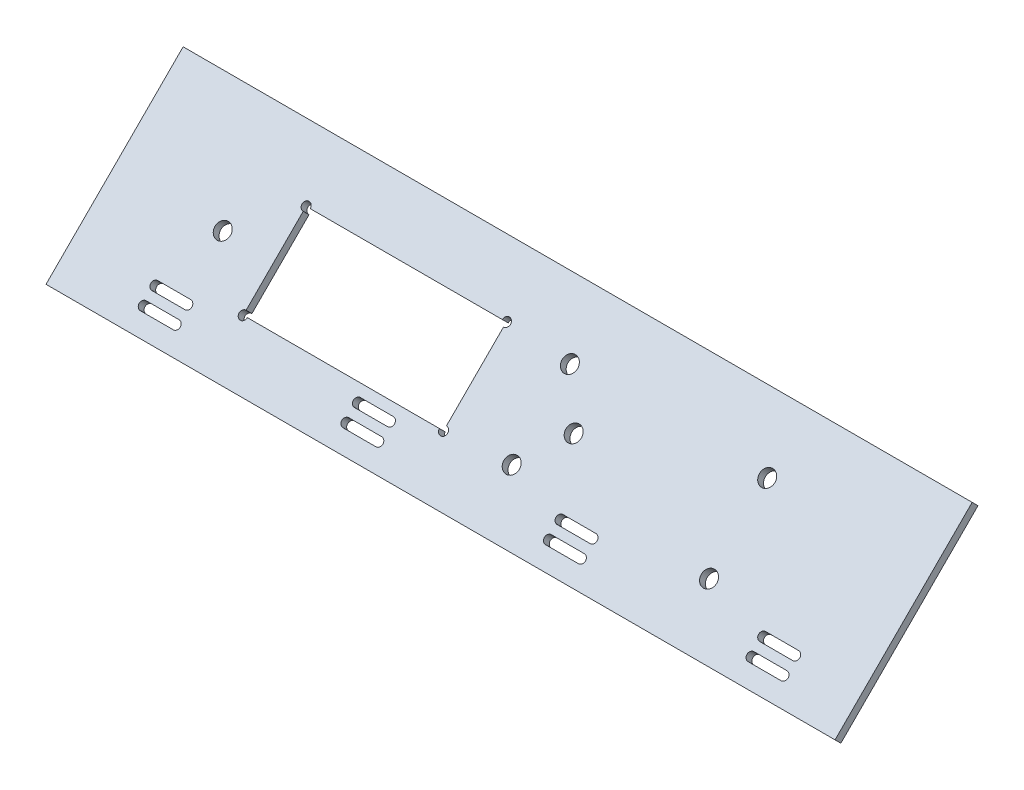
SolidWorks part; units mm, degrees
ref_plane "Front Plane" through (0, 0, 0) normal (0, 0, 1) x (1, 0, 0)
ref_plane "Top Plane" through (0, 0, 0) normal (0, 1, 0) x (1, 0, 0)
ref_plane "Right Plane" through (0, 0, 0) normal (1, 0, 0) x (0, 0, -1)
sketch "Sketch2" plane through (0, 874.2582, 874.2582) normal (0, 0.7071, 0.7071) x (1, 0, 0)
  line L0 (-880.4529, -726.3115) -> (-867.7529, -726.3115) construction
  line L1 (-867.7529, -723.1365) -> (-880.4529, -723.1365) construction
  line L2 (-867.7529, -729.4865) -> (-880.4529, -729.4865) construction
  line L3 (-880.4529, -732.6615) -> (-867.7529, -732.6615) construction
  line L4 (-802.2209, -732.6615) -> (-789.5209, -732.6615) construction
  line L5 (-789.5209, -729.4865) -> (-802.2209, -729.4865) construction
  line L6 (-802.2209, -726.3115) -> (-789.5209, -726.3115) construction
  line L7 (-789.5209, -723.1365) -> (-802.2209, -723.1365) construction
  line L8 (-711.2889, -723.1365) -> (-723.9889, -723.1365) construction
  line L9 (-723.9889, -726.3115) -> (-711.2889, -726.3115) construction
  line L10 (-711.2889, -729.4865) -> (-723.9889, -729.4865) construction
  line L11 (-723.9889, -732.6615) -> (-711.2889, -732.6615) construction
  line L12 (-645.7569, -726.3115) -> (-633.0569, -726.3115) construction
  line L13 (-633.0569, -723.1365) -> (-645.7569, -723.1365) construction
  line L14 (-633.0569, -729.4865) -> (-645.7569, -729.4865) construction
  line L15 (-645.7569, -732.6615) -> (-633.0569, -732.6615) construction
  line L16 (-607.5404, -664.399) -> (-607.5404, -739.2838) construction
  line L17 (-607.5404, -664.399) -> (-912.2029, -664.399) construction
  line L18 (-912.2029, -664.399) -> (-912.2029, -739.2838) construction
  line L19 (-607.5404, -739.2838) -> (-912.2029, -739.2838) construction
  line L20 (-880.4529, -726.3115) -> (-867.7529, -726.3115)
  line L21 (-867.7529, -723.1365) -> (-880.4529, -723.1365)
  line L22 (-867.7529, -729.4865) -> (-880.4529, -729.4865)
  line L23 (-880.4529, -732.6615) -> (-867.7529, -732.6615)
  line L24 (-802.2209, -732.6615) -> (-789.5209, -732.6615)
  line L25 (-789.5209, -729.4865) -> (-802.2209, -729.4865)
  line L26 (-802.2209, -726.3115) -> (-789.5209, -726.3115)
  line L27 (-789.5209, -723.1365) -> (-802.2209, -723.1365)
  line L28 (-711.2889, -723.1365) -> (-723.9889, -723.1365)
  line L29 (-723.9889, -726.3115) -> (-711.2889, -726.3115)
  line L30 (-711.2889, -729.4865) -> (-723.9889, -729.4865)
  line L31 (-723.9889, -732.6615) -> (-711.2889, -732.6615)
  line L32 (-645.7569, -726.3115) -> (-633.0569, -726.3115)
  line L33 (-633.0569, -723.1365) -> (-645.7569, -723.1365)
  line L34 (-633.0569, -729.4865) -> (-645.7569, -729.4865)
  line L35 (-645.7569, -732.6615) -> (-633.0569, -732.6615)
  line L36 (-607.5404, -664.399) -> (-607.5404, -739.2838)
  line L37 (-607.5404, -664.399) -> (-912.2029, -664.399)
  line L38 (-912.2029, -664.399) -> (-912.2029, -739.2838)
  line L39 (-607.5404, -739.2838) -> (-912.2029, -739.2838)
  circle A0 centre (-670.9716, -686.624) radius 3 construction
  circle A1 centre (-670.9716, -718.374) radius 3 construction
  circle A2 centre (-747.1716, -718.374) radius 3 construction
  circle A3 centre (-734.4716, -702.499) radius 3 construction
  circle A4 centre (-747.1716, -686.624) radius 3 construction
  circle A5 centre (-869.9716, -702.499) radius 3 construction
  arc A6 (-880.4529, -723.1365) -> (-880.4529, -726.3115) centre (-880.4529, -724.724) ccw construction
  arc A7 (-867.7529, -726.3115) -> (-867.7529, -723.1365) centre (-867.7529, -724.724) ccw construction
  arc A8 (-867.7529, -732.6615) -> (-867.7529, -729.4865) centre (-867.7529, -731.074) ccw construction
  arc A9 (-880.4529, -729.4865) -> (-880.4529, -732.6615) centre (-880.4529, -731.074) ccw construction
  arc A10 (-789.5209, -732.6615) -> (-789.5209, -729.4865) centre (-789.5209, -731.074) ccw construction
  arc A11 (-802.2209, -729.4865) -> (-802.2209, -732.6615) centre (-802.2209, -731.074) ccw construction
  arc A12 (-802.2209, -723.1365) -> (-802.2209, -726.3115) centre (-802.2209, -724.724) ccw construction
  arc A13 (-789.5209, -726.3115) -> (-789.5209, -723.1365) centre (-789.5209, -724.724) ccw construction
  arc A14 (-723.9889, -723.1365) -> (-723.9889, -726.3115) centre (-723.9889, -724.724) ccw construction
  arc A15 (-723.9889, -729.4865) -> (-723.9889, -732.6615) centre (-723.9889, -731.074) ccw construction
  arc A16 (-711.2889, -732.6615) -> (-711.2889, -729.4865) centre (-711.2889, -731.074) ccw construction
  arc A17 (-711.2889, -726.3115) -> (-711.2889, -723.1365) centre (-711.2889, -724.724) ccw construction
  arc A18 (-645.7569, -723.1365) -> (-645.7569, -726.3115) centre (-645.7569, -724.724) ccw construction
  arc A19 (-633.0569, -726.3115) -> (-633.0569, -723.1365) centre (-633.0569, -724.724) ccw construction
  arc A20 (-633.0569, -732.6615) -> (-633.0569, -729.4865) centre (-633.0569, -731.074) ccw construction
  arc A21 (-645.7569, -729.4865) -> (-645.7569, -732.6615) centre (-645.7569, -731.074) ccw construction
  circle A22 centre (-670.9716, -686.624) radius 3
  circle A23 centre (-670.9716, -718.374) radius 3
  circle A24 centre (-747.1716, -718.374) radius 3
  circle A25 centre (-734.4716, -702.499) radius 3
  circle A26 centre (-747.1716, -686.624) radius 3
  circle A27 centre (-869.9716, -702.499) radius 3
  arc A28 (-880.4529, -723.1365) -> (-880.4529, -726.3115) centre (-880.4529, -724.724) ccw
  arc A29 (-867.7529, -726.3115) -> (-867.7529, -723.1365) centre (-867.7529, -724.724) ccw
  arc A30 (-867.7529, -732.6615) -> (-867.7529, -729.4865) centre (-867.7529, -731.074) ccw
  arc A31 (-880.4529, -729.4865) -> (-880.4529, -732.6615) centre (-880.4529, -731.074) ccw
  arc A32 (-789.5209, -732.6615) -> (-789.5209, -729.4865) centre (-789.5209, -731.074) ccw
  arc A33 (-802.2209, -729.4865) -> (-802.2209, -732.6615) centre (-802.2209, -731.074) ccw
  arc A34 (-802.2209, -723.1365) -> (-802.2209, -726.3115) centre (-802.2209, -724.724) ccw
  arc A35 (-789.5209, -726.3115) -> (-789.5209, -723.1365) centre (-789.5209, -724.724) ccw
  arc A36 (-723.9889, -723.1365) -> (-723.9889, -726.3115) centre (-723.9889, -724.724) ccw
  arc A37 (-723.9889, -729.4865) -> (-723.9889, -732.6615) centre (-723.9889, -731.074) ccw
  arc A38 (-711.2889, -732.6615) -> (-711.2889, -729.4865) centre (-711.2889, -731.074) ccw
  arc A39 (-711.2889, -726.3115) -> (-711.2889, -723.1365) centre (-711.2889, -724.724) ccw
  arc A40 (-645.7569, -723.1365) -> (-645.7569, -726.3115) centre (-645.7569, -724.724) ccw
  arc A41 (-633.0569, -726.3115) -> (-633.0569, -723.1365) centre (-633.0569, -724.724) ccw
  arc A42 (-633.0569, -732.6615) -> (-633.0569, -729.4865) centre (-633.0569, -731.074) ccw
  arc A43 (-645.7569, -729.4865) -> (-645.7569, -732.6615) centre (-645.7569, -731.074) ccw
extrude "Boss-Extrude1" add sketch "Sketch2" along normal blind 3.175
sketch "Sketch3" plane through (0, 876.5033, 876.5033) normal (0, 0.7071, 0.7071) x (1, 0, 0)
  line L0 (-869.9716, -702.499) -> (-734.4716, -702.499) construction
  line L2 (-849.9216, -685.324) -> (-772.5716, -685.324)
  line L3 (-747.1716, -718.374) -> (-747.1716, -686.624) construction
  line L4 (-849.9216, -685.324) -> (-849.9216, -719.674)
  line L5 (-846.7466, -688.499) -> (-775.7466, -688.499) construction
  line L6 (-846.7466, -688.499) -> (-846.7466, -716.499) construction
  line L7 (-846.7466, -716.499) -> (-775.7466, -716.499) construction
  line L8 (-775.7466, -688.499) -> (-775.7466, -716.499) construction
  line L9 (-849.9216, -719.674) -> (-772.5716, -719.674)
  line L10 (-772.5716, -685.324) -> (-772.5716, -719.674)
  point P13 (-775.7466, -702.499)
  dimension "D1" = 28
  dimension "D2" = 71
  dimension "D3" = 28.575
  dimension "D4" = 3.175
  dimension "D5" = 3.175
  dimension "D6" = 3.175
  dimension "D7" = 3.175
extrude "Cut-Extrude1" cut sketch "Sketch3" against normal blind 3.175
sketch "Sketch4" plane through (0, 876.5033, 876.5033) normal (0, 0.7071, 0.7071) x (1, 0, 0)
  circle A0 centre (-849.9216, -685.324) radius 1.5875
  circle A1 centre (-849.9216, -719.674) radius 1.5875
  circle A2 centre (-772.5716, -719.674) radius 1.5875
  circle A3 centre (-772.5716, -685.324) radius 1.5875
  dimension "D1" = 3.175
  dimension "D2" = 3.175
  dimension "D3" = 3.175
  dimension "D4" = 3.175
extrude "Cut-Extrude2" cut sketch "Sketch4" against normal through all
